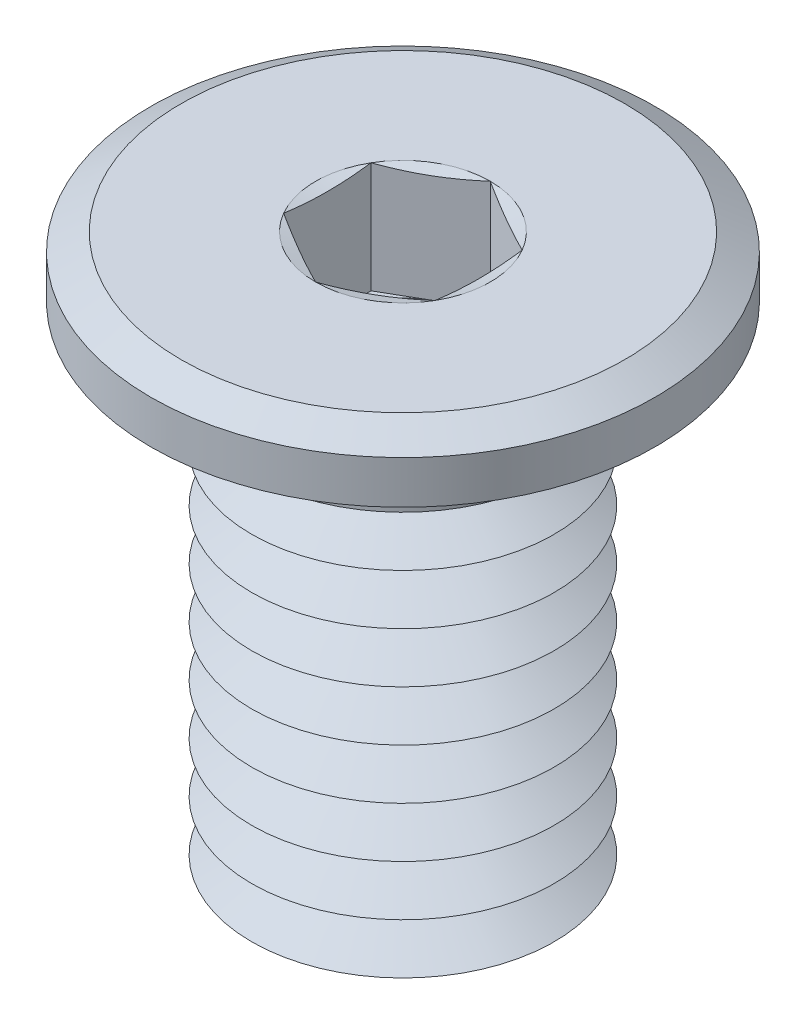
SolidWorks part; units mm, degrees
ref_plane "Front Plane" through (0, 0, 0) normal (0, 0, 1) x (1, 0, 0)
ref_plane "Top Plane" through (0, 0, 0) normal (0, 1, 0) x (1, 0, 0)
ref_plane "Right Plane" through (0, 0, 0) normal (1, 0, 0) x (0, 0, -1)
sketch "Sketch1" plane through (0, 0, 0) normal (0, 1, 0) x (1, 0, 0)
  circle A0 centre (0, 0) radius 5
  dimension "D1" = 10
extrude "Boss-Extrude1" add sketch "Sketch1" against normal blind 1.2
sketch "Sketch2" plane through (0, -1.2, 0) normal (0, -1, 0) x (1, 0, 0)
  circle A0 centre (0, 0) radius 3
  dimension "D1" = 6
extrude "Boss-Extrude2" add sketch "Sketch2" along normal blind 10
sketch "Sketch3" plane through (0, 0, 0) normal (1, 0, 0) x (0, 0, -1)
  line L0 (0, 0.9906) -> (0, -8.2999) construction
sketch "Sketch5" plane through (0, 0, 0) normal (1, 0, 0) x (0, 0, -1)
  line L0 (-3, -11.7) -> (-2.134, -11.2)
  line L1 (-3, -1.2) -> (-3, -11.2) construction
  line L2 (-2.134, -11.2) -> (-3, -10.7)
  line L3 (-3, -1.2) -> (-3, -11.2) construction
  line L4 (-3, -10.7) -> (-3, -11.7)
  line L6 (-3, -1.2) -> (-3, -11.2) construction
  line L7 (-3, -1.2) -> (-3, -11.2) construction
  line L14 (-3, -11.2) -> (3, -11.2) construction
  dimension "D1" = 1
revolve "Cut-Revolve1" cut sketch "Sketch5" angle 360 about L0
pattern_linear "LPattern1" count 9 spacing 1 along (0, 1, 0) of "Cut-Revolve1"
fillet "Fillet1" radius 0.25 1 edges at (0, -1.2, -3)
chamfer "Chamfer2" distance 0.6 angle 30 1 edges at (0, 0, 5)
sketch "Sketch6" plane through (0, 0, 0) normal (0, 1, 0) x (1, 0, 0)
  line L1 (0, 1.7321) -> (-1.5, 0.866)
  line L2 (-1.5, 0.866) -> (-1.5, -0.866)
  line L3 (-1.5, -0.866) -> (0, -1.7321)
  line L4 (0, -1.7321) -> (1.5, -0.866)
  line L5 (1.5, -0.866) -> (1.5, 0.866)
  line L6 (1.5, 0.866) -> (0, 1.7321)
  circle A0 centre (0, 0) radius 1.5 construction
  dimension "D1" = 3
extrude "Cut-Extrude1" cut sketch "Sketch6" against normal blind 2.2
sketch "Sketch7" plane through (0, -2.2, 0) normal (0, 1, 0) x (1, 0, 0)
  line L0 (-1.5, 0.866) -> (-1.5, -0.866) construction
  circle A0 centre (0, 0) radius 1.5
extrude "Cut-Extrude2" cut sketch "Sketch7" against normal through all draft 60
sketch "Sketch8" plane through (0, 0, 0) normal (0, 1, 0) x (1, 0, 0)
  circle A0 centre (0, 0) radius 1.7321
extrude "Cut-Extrude3" cut sketch "Sketch8" against normal through all draft 75
